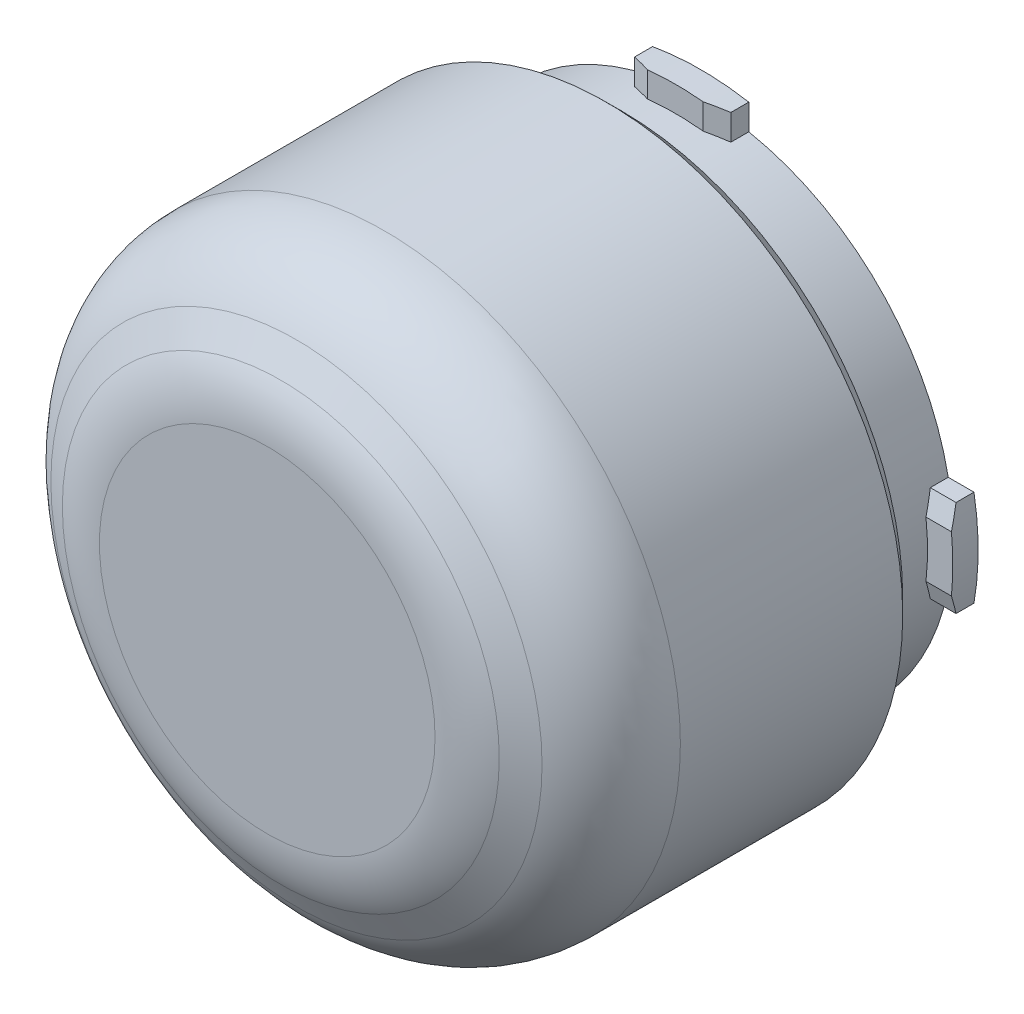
SolidWorks part; units mm, degrees
ref_plane "Front Plane" through (0, 0, 0) normal (0, 0, 1) x (1, 0, 0)
ref_plane "Top Plane" through (0, 0, 0) normal (0, 1, 0) x (1, 0, 0)
ref_plane "Right Plane" through (0, 0, 0) normal (1, 0, 0) x (0, 0, -1)
sketch "Sketch1" plane through (0, 0, 0) normal (0, 0, 1) x (1, 0, 0)
  circle A0 centre (0, 0) radius 29.25
  dimension "D1" = 58.5
extrude "Boss-Extrude1" add sketch "Sketch1" along normal blind 35
chamfer "Chamfer1" distance 10 angle 30 1 edges at (29.25, 0, 35)
shell "Shell1" thickness 2.5
sketch "Sketch4" plane through (0, 0, 0) normal (0, 0, -1) x (-1, 0, 0)
  circle A0 centre (0, 0) radius 26.75
  circle A1 centre (0, 0) radius 24.9
  circle A2 centre (0, 0) radius 26.75 construction
  dimension "D1" = 49.8
extrude "Boss-Extrude4" add sketch "Sketch4" against normal blind 2.5
sketch "Sketch6" plane through (0, 0, 0) normal (0, 0, -1) x (-1, 0, 0)
  circle A0 centre (0, 0) radius 24.9
  circle A1 centre (0, 0) radius 24.9 construction
  circle A2 centre (0, 0) radius 22.9
  dimension "D1" = 2
extrude "Boss-Extrude5" add sketch "Sketch6" along normal blind 7.8 and the other way up to surface
sketch "Sketch7" plane through (0, 0, -7.8) normal (0, 0, -1) x (-1, 0, 0)
  line L0 (0, 0) -> (0, 50000) construction
  line L1 (-4.75, 26.9851) -> (-4.75, 24.4427)
  line L2 (-4.75, 14.9) -> (4.75, 14.9) construction
  line L3 (-4.75, 14.9) -> (-4.75, 34.9) construction
  line L4 (-4.75, 34.9) -> (4.75, 34.9) construction
  line L5 (4.75, 14.9) -> (4.75, 34.9) construction
  line L6 (-4.75, 14.9) -> (4.75, 34.9) construction
  line L7 (-4.75, 34.9) -> (4.75, 14.9) construction
  line L8 (4.75, 26.9851) -> (4.75, 24.4427)
  circle A0 centre (0, 0) radius 27.4 construction
  circle A1 centre (0, 0) radius 24.9 construction
  arc A2 (-4.75, 24.4427) -> (4.75, 24.4427) centre (0, 0) cw
  circle A3 centre (0, 0) radius 24.9 construction
  arc A4 (-4.75, 26.9851) -> (4.75, 26.9851) centre (0, 0) cw
  point P3 (0, 24.9)
  dimension "D1" = 9.5
  dimension "D3" = 2.5
  dimension "D2" = 20
extrude "Boss-Extrude6" add sketch "Sketch7" against normal blind 2.5
chamfer "Chamfer2" distance 2 angle 20 2 edges at (4.75, 25.7139, -5.3) (-4.75, 25.7139, -5.3)
pattern_circular "CirPattern1" count 4 over 360 about axis through (0, 0, 0) along (0, 0, 1) of "Boss-Extrude6", "Chamfer2"
chamfer "Chamfer3" distance 4.5 angle 45 1 edges at (-26.75, 0, 2.5)
chamfer "Chamfer4" distance 1.5 angle 45 1 edges at (29.25, 0, 0)
fillet "Fillet1" radius 10 2 edges at (19.25, 0, 35) (29.25, 0, 29.2265)
